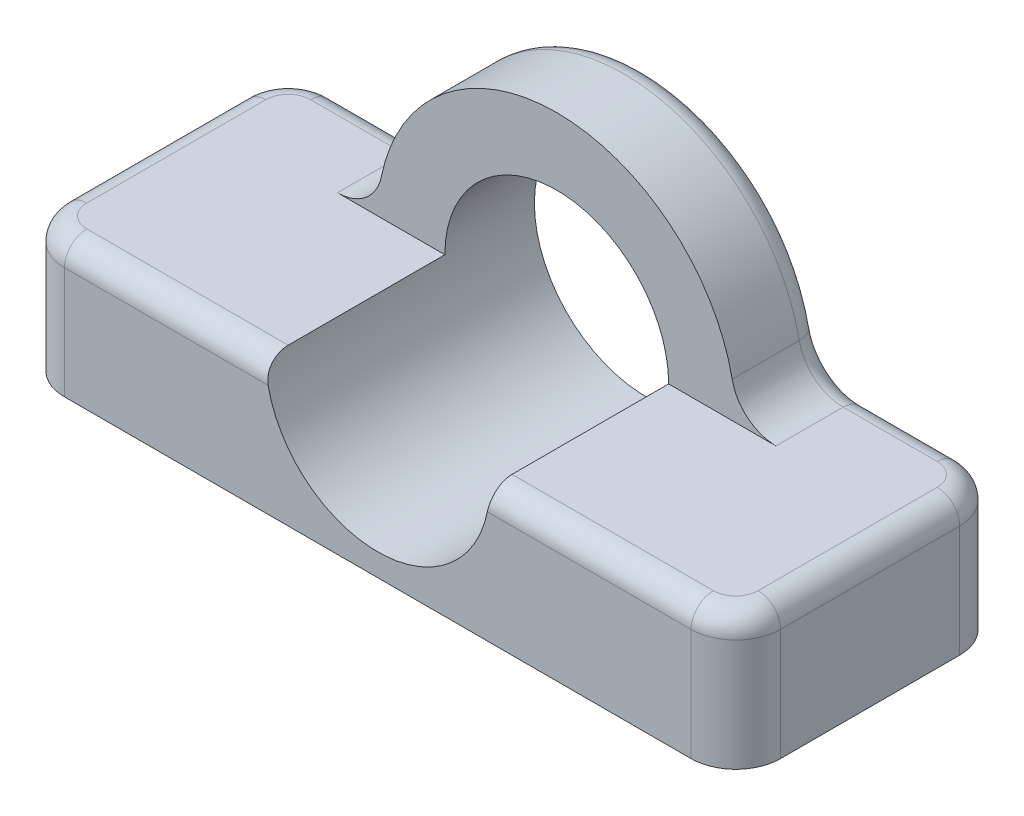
SolidWorks part; units mm, degrees
ref_plane "Front" through (0, 0, 0) normal (0, 0, 1) x (1, 0, 0)
ref_plane "Top" through (0, 0, 0) normal (0, 1, 0) x (1, 0, 0)
ref_plane "Right" through (0, 0, 0) normal (1, 0, 0) x (0, 0, -1)
sketch "Sketch1" plane through (0, 0, 0) normal (0, 1, 0) x (1, 0, 0)
  line L1 (0, 0) -> (101.6, 0)
  line L2 (0, 0) -> (0, 38.1)
  line L3 (0, 38.1) -> (101.6, 38.1)
  line L4 (101.6, 0) -> (101.6, 38.1)
  dimension "D1" = 101.6
  dimension "D2" = 38.1
extrude "Base-Extrude" add sketch "Sketch1" along normal blind 19.05
ref_plane "Plane1" through (50.8, 0, 0) normal (-1, 0, 0) x (0, 0, 1)
sketch "Sketch2" plane through (0, 0, -38.1) normal (0, 0, -1) x (-1, 0, 0)
  line L0 (-101.6, 19.05) -> (0, 19.05) construction
  line L1 (-25.4, 19.05) -> (-76.2, 19.05)
  arc A0 (-76.2, 19.05) -> (-25.4, 19.05) centre (-50.8, 19.05) cw
  dimension "D1" = 50.8
extrude "Boss-Extrude1" add sketch "Sketch2" against normal blind 12.7
fillet "Fillet1" radius 6.35 2 edges at (76.2, 19.05, -31.75) (25.4, 19.05, -31.75)
sketch "Sketch3" plane through (0, 0, -38.1) normal (0, 0, -1) x (-1, 0, 0)
  circle A0 centre (-50.8, 19.05) radius 15.875
  dimension "D1" = 31.75
extrude "Cut-Extrude1" cut sketch "Sketch3" against normal through all
fillet "Fillet2" radius 6.35 4 edges at (0, 9.525, -38.1) (101.6, 9.525, -38.1) (101.6, 9.525, 0) (0, 9.525, 0)
fillet "Fillet3" radius 3.175 13 edges at (50.8, 44.45, -38.1) (13.0207, 19.05, -38.1) (77.8924, 20.4813, -38.1) (23.7076, 20.4813, -38.1) (80.9625, 19.05, 0) (101.6, 19.05, -19.05) (20.6375, 19.05, 0) (88.5793, 19.05, -38.1) (99.7401, 19.05, -36.2401) (99.7401, 19.05, -1.8599) (0, 19.05, -19.05) (1.8599, 19.05, -1.8599) (1.8599, 19.05, -36.2401)
